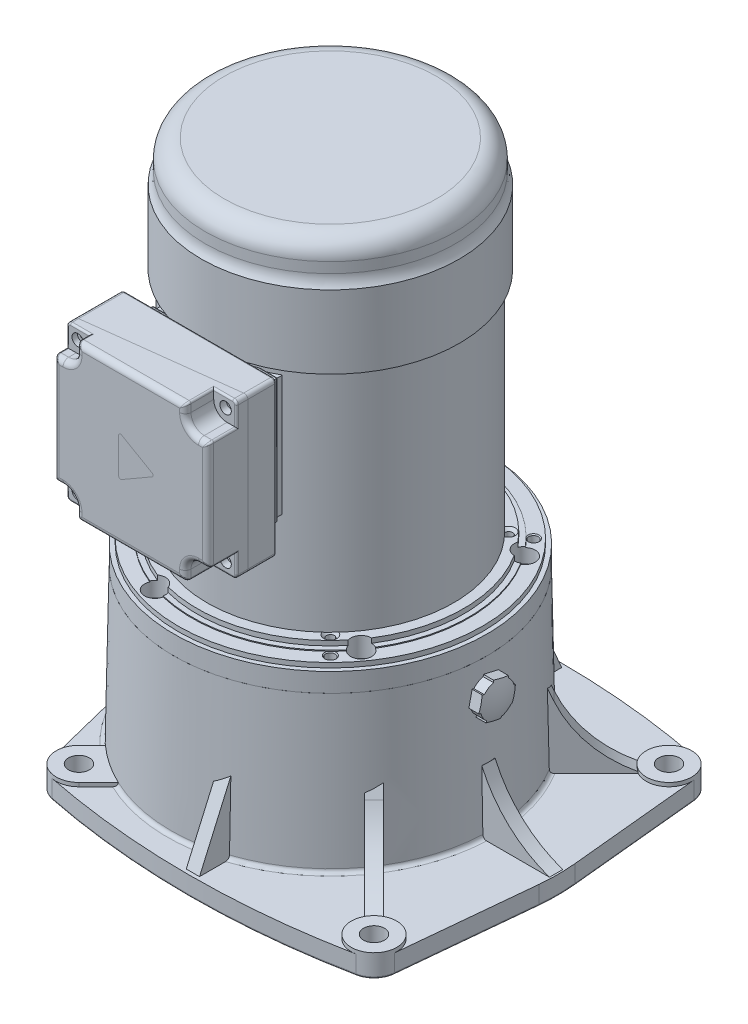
SolidWorks part; units mm, degrees
ref_plane "前视基准面" through (0, 0, 0) normal (0, 0, 1) x (1, 0, 0)
ref_plane "上视基准面" through (0, 0, 0) normal (0, 1, 0) x (1, 0, 0)
ref_plane "右视基准面" through (0, 0, 0) normal (1, 0, 0) x (0, 0, -1)
imported_body "接线盒座-1-surface1"
imported_body "接线盒座-1-surface2"
imported_body "接线盒座-1-surface3"
imported_body "接线盒座-1-surface4"
imported_body "接线盒座-1-surface5"
imported_body "接线盒座-1-surface6"
imported_body "接线盒盖-1-surface1"
imported_body "接线盒盖-1-surface2"
imported_body "接线盒盖-1-surface3"
imported_body "接线盒盖-1-surface4"
imported_body "接线盒盖-1-surface5"
imported_body "立式箱体装配体1-1/28A立式箱体-1-surface1"
imported_body "立式箱体装配体1-1/28输出轴-1-surface1"
imported_body "立式箱体装配体1-1/28输出轴-1-surface2"
imported_body "立式箱体装配体1-1/16.04.20 28箱盖配B版电机1500-1-surface1"
imported_body "立式箱体装配体1-1/GB／T13871．1-2007唇形密封圈B型B15 30X45X7-1-surface1"
imported_body "立式箱体装配体1-1/7X40-1-surface1"
imported_body "立式箱体装配体1-1/透气塞-1-surface1"
sketch "草图1" plane through (0, -132.4058, 0) normal (0, 1, 0) x (1, 0, 0)
  circle A0 centre (97.6607, -4.6646) radius 65
  circle A1 centre (120.6607, -4.6646) radius 23 construction
extrude "凸台-拉伸1" add sketch "草图1" along normal blind 120
sketch "草图3" plane through (0, -12.4058, 0) normal (0, 1, 0) x (1, 0, 0)
  circle A0 centre (97.6607, -4.6646) radius 68
extrude "凸台-拉伸2" add sketch "草图3" along normal blind 38.5
sketch "草图4" plane through (0, 26.0942, 0) normal (0, 1, 0) x (1, 0, 0)
  circle A0 centre (97.6607, -4.6646) radius 66
extrude "凸台-拉伸3" add sketch "草图4" along normal blind 21.5
fillet "圆角1" radius 10 2 edges at (97.6607, 47.5942, 70.6646) (97.6607, 26.0942, 70.6646)
